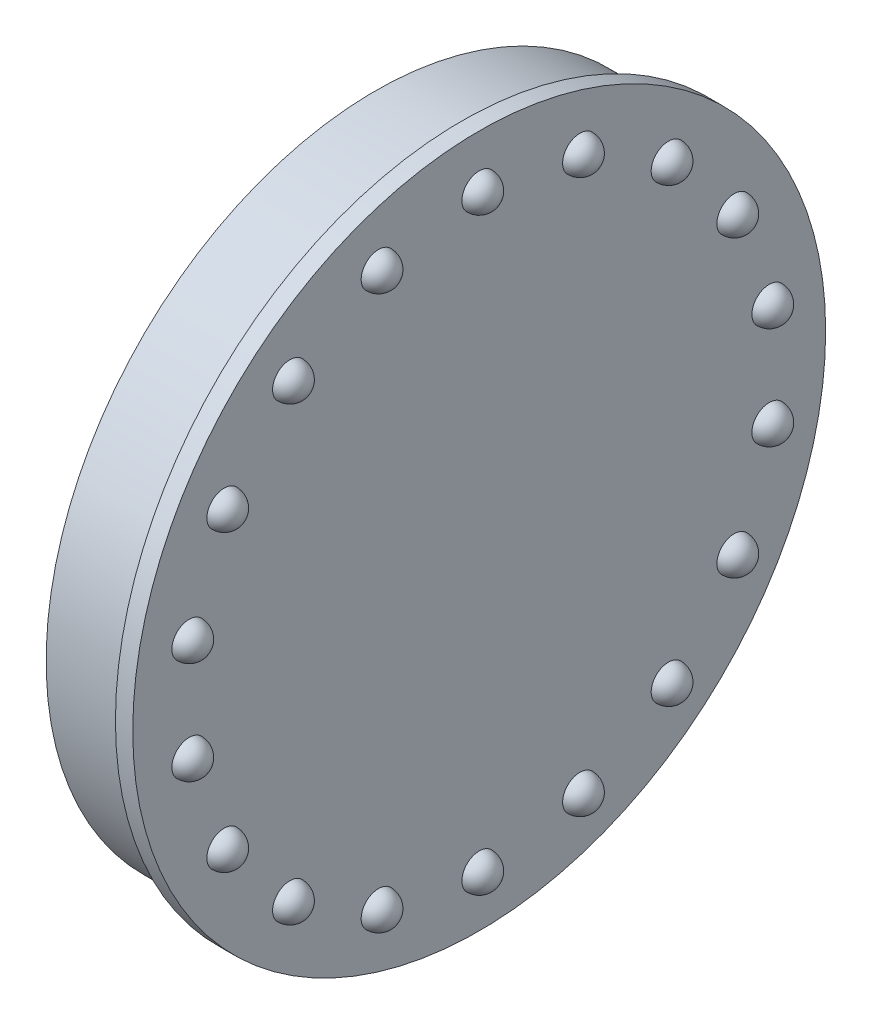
SolidWorks part; units mm, degrees
ref_plane "Front" through (0, 0, 0) normal (0, 0, 1) x (1, 0, 0)
ref_plane "Top" through (0, 0, 0) normal (0, 1, 0) x (1, 0, 0)
ref_plane "Right" through (0, 0, 0) normal (1, 0, 0) x (0, 0, -1)
sketch "Sketch1" plane through (0, 0, 0) normal (1, 0, 0) x (0, 0, -1)
  circle A0 centre (0, 0) radius 19
extrude "Extrude1" add sketch "Sketch1" along normal blind 5
sketch "Sketch2" plane through (5, 0, 0) normal (1, 0, 0) x (0, 0, -1)
  circle A0 centre (0, 0) radius 20
extrude "Extrude2" add sketch "Sketch2" along normal blind 1
sketch "Sketch3" plane through (6, 0, 0) normal (1, 0, 0) x (0, 0, -1)
  circle A1 centre (0, -17) radius 1
  circle A2 centre (-5.8143, -15.9748) radius 1
  circle A3 centre (-10.9274, -13.0228) radius 1
  circle A4 centre (-14.7224, -8.5) radius 1
  circle A5 centre (-16.7417, -2.952) radius 1
  circle A6 centre (-16.7417, 2.952) radius 1
  circle A7 centre (-14.7224, 8.5) radius 1
  circle A8 centre (-10.9274, 13.0228) radius 1
  circle A9 centre (-5.8143, 15.9748) radius 1
  circle A10 centre (0, 17) radius 1
  circle A11 centre (5.8143, 15.9748) radius 1
  circle A12 centre (10.9274, 13.0228) radius 1
  circle A13 centre (14.7224, 8.5) radius 1
  circle A14 centre (16.7417, 2.952) radius 1
  circle A15 centre (16.7417, -2.952) radius 1
  circle A16 centre (14.7224, -8.5) radius 1
  circle A17 centre (10.9274, -13.0228) radius 1
  circle A18 centre (5.8143, -15.9748) radius 1
extrude "Extrude3" add sketch "Sketch3" along normal blind 1
fillet "Fillet1" radius 1 1 edges at (7, 15.9748, -6.8143)
fillet "Fillet2" radius 1 17 edges at (7, 13.0228, -11.9274) (7, 8.5, -15.7224) (7, 2.952, -17.7417) (7, -2.952, -17.7417) (7, -8.5, -15.7224) (7, -13.0228, -11.9274) (7, -15.9748, -6.8143) (7, -17, -1) (7, -15.9748, 4.8143) (7, -13.0228, 9.9274) (7, -8.5, 13.7224) (7, -2.952, 15.7417) (7, 2.952, 15.7417) (7, 8.5, 13.7224) (7, 13.0228, 9.9274) (7, 15.9748, 4.8143) (7, 17, -1)
